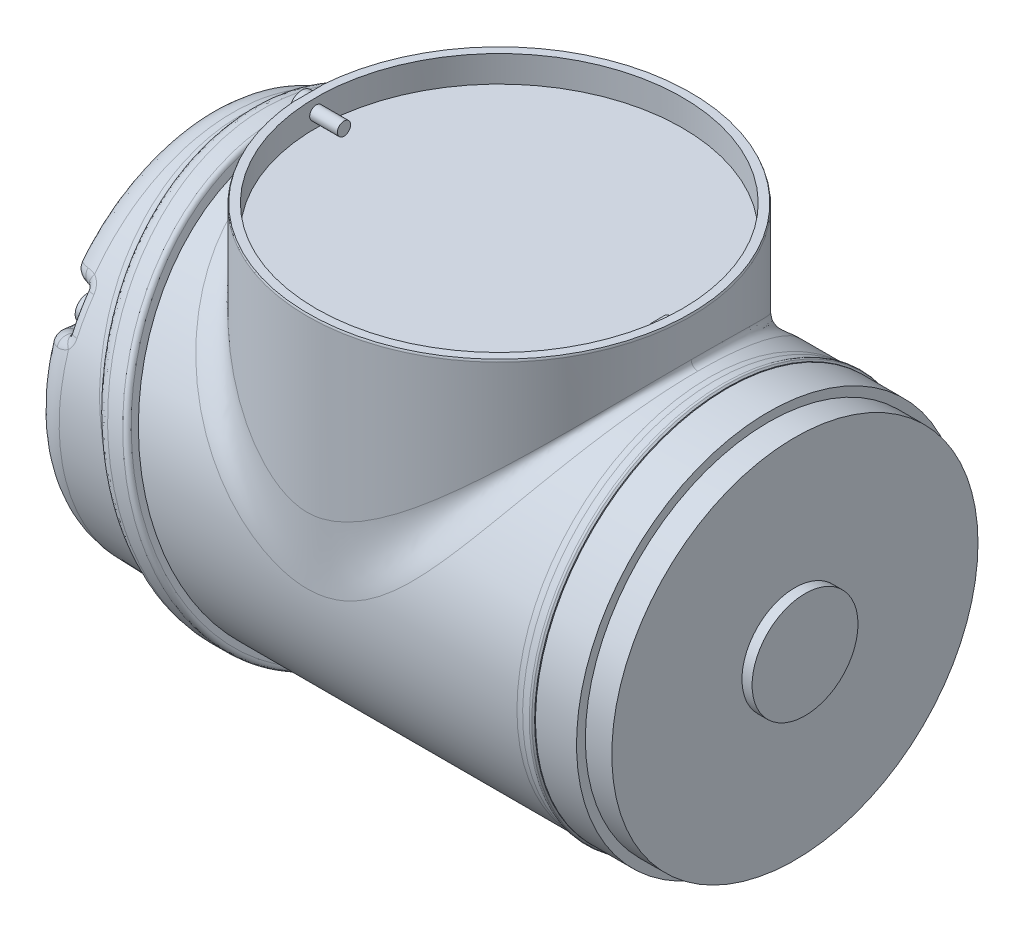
SolidWorks part; units mm, degrees
ref_plane "前视基准面" through (0, 0, 0) normal (0, 0, 1) x (1, 0, 0)
ref_plane "上视基准面" through (0, 0, 0) normal (0, 1, 0) x (1, 0, 0)
ref_plane "右视基准面" through (0, 0, 0) normal (1, 0, 0) x (0, 0, -1)
other "Configuration Table"
imported_body "输入1"
surface "曲面填充1"
other "外发实心化_填充内部"
